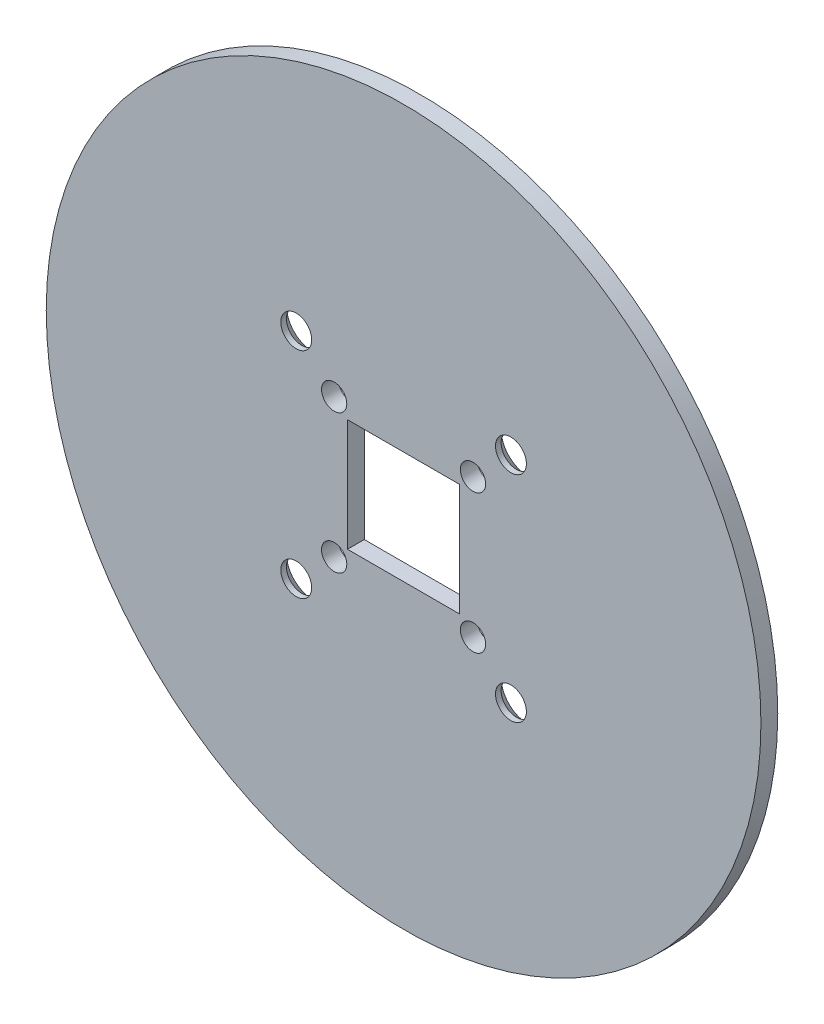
SolidWorks part; units mm, degrees
ref_plane "Plan de face" through (0, 0, 0) normal (0, 0, 1) x (1, 0, 0)
ref_plane "Plan de dessus" through (0, 0, 0) normal (0, 1, 0) x (1, 0, 0)
ref_plane "Plan de droite" through (0, 0, 0) normal (1, 0, 0) x (0, 0, -1)
sketch "Esquisse1" plane through (0, 0, 0) normal (0, 0, 1) x (1, 0, 0)
  line L0 (-60.6442, 0) -> (58.9534, 0) construction
  line L1 (0, 71.2062) -> (0, -63.694) construction
  line L2 (0, 0) -> (19.1342, 46.194) construction
  line L3 (-10, 10) -> (-10, -10)
  line L4 (-10, 10) -> (10, 10)
  line L5 (-63.694, -26.3829) -> (-26.3829, -63.694)
  line L6 (-10, -10) -> (10, -10)
  line L7 (10, 10) -> (10, -10)
  line L8 (26.3829, 63.694) -> (63.694, 26.3829)
  line L9 (26.3829, 63.694) -> (-26.3829, 63.694)
  line L10 (63.694, 26.3829) -> (63.694, -26.3829)
  line L11 (63.694, -26.3829) -> (26.3829, -63.694)
  line L12 (26.3829, -63.694) -> (-26.3829, -63.694)
  line L13 (-63.694, 26.3829) -> (-63.694, -26.3829)
  line L14 (-26.3829, 63.694) -> (-63.694, 26.3829)
  circle A0 centre (19.1342, 46.194) radius 17.5 construction
  circle A1 centre (46.194, 19.1342) radius 17.5 construction
  circle A2 centre (46.194, -19.1342) radius 17.5 construction
  circle A3 centre (19.1342, -46.194) radius 17.5 construction
  circle A4 centre (19.1342, 19.1342) radius 2.75
  circle A5 centre (19.1342, -19.1342) radius 2.75
  circle A6 centre (-19.1342, -19.1342) radius 2.75
  circle A7 centre (-19.1342, 19.1342) radius 2.75
  circle A28 centre (-19.1342, 46.194) radius 17.5 construction
  circle A29 centre (-46.194, 19.1342) radius 17.5 construction
  circle A30 centre (-46.194, -19.1342) radius 17.5 construction
  circle A31 centre (-19.1342, -46.194) radius 17.5 construction
  point P23 (0, 10)
  point P24 (0, -10)
  point P29 (0, 63.694)
  dimension "D1" = 35
  dimension "D6" = 10
  dimension "D7" = 10
  dimension "D5" = 5.5
  dimension "D2" = 22.5
  dimension "D3" = 50
  dimension "D8" = 20
  dimension "D4" = 8
extrude "Boss.-Extru.1" add sketch "Esquisse1" along normal blind 3
sketch "Esquisse2" [suppressed] plane through (0, 0, 0) normal (0, 0, 1) x (1, 0, 0)
  line L0 (0, 40.1423) -> (0, -68.4169) construction
  line L1 (-82.3389, 0) -> (88.7863, 0) construction
  line L2 (0, 0) -> (19.1342, -46.194) construction
  line L3 (0, 0) -> (46.194, -19.1342) construction
  line L4 (0, 0) -> (-19.1342, -46.194) construction
  line L5 (0, 0) -> (-46.194, -19.1342) construction
  line L6 (0, 0) -> (-46.194, 19.1342) construction
  line L7 (0, 0) -> (46.194, 19.1342) construction
  circle A0 centre (19.1342, -46.194) radius 16.75 construction
  circle A1 centre (46.194, -19.1342) radius 16.75 construction
  circle A2 centre (-19.1342, -46.194) radius 16.75 construction
  circle A3 centre (-46.194, 19.1342) radius 16.75 construction
  circle A4 centre (-46.194, -19.1342) radius 16.75 construction
  circle A5 centre (46.194, 19.1342) radius 16.75 construction
  circle A6 centre (14.6755, -15.3477) radius 16.75 construction
  circle A7 centre (-14.5592, -15.3477) radius 16.75 construction
  dimension "D2" = 33.5
  dimension "D1" = 50
  dimension "D3" = 22.5
  dimension "D4" = 45
  dimension "D5" = 22.5
  dimension "D6" = 45
  dimension "D7" = 45
  dimension "D8" = 45
chamfer "Chanfrein1" distance 2 angle 45 4 edges at (21.8842, -19.1342, 0) (-21.8842, -19.1342, 0) (-21.8842, 19.1342, 0) (21.8842, 19.1342, 0)
sketch "Esquisse3" plane through (0, 0, 0) normal (0, 0, -1) x (-1, 0, 0)
  circle A0 centre (12.3744, 12.3744) radius 2.25
  circle A1 centre (12.3744, -12.3744) radius 2.25
  circle A2 centre (-12.3744, 12.3744) radius 2.25
  circle A3 centre (-12.3744, -12.3744) radius 2.25
extrude "Enlèv. mat.-Extru.1" cut sketch "Esquisse3" against normal blind 10
sketch "Esquisse4" plane through (0, 0, 0) normal (0, 0, -1) x (-1, 0, 0)
  circle A0 centre (0, 0) radius 63.694
extrude "Enlèv. mat.-Extru.2" cut sketch "Esquisse4" against normal blind 10 flip side to cut
